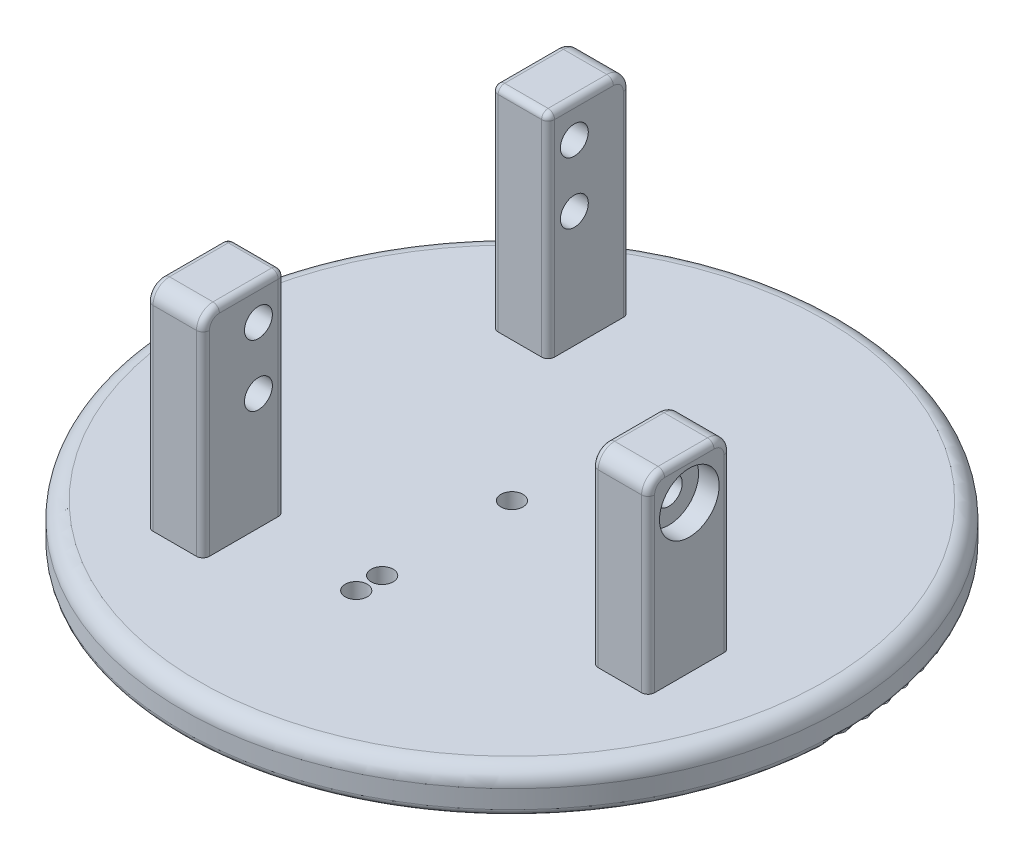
SolidWorks part; units mm, degrees
ref_plane "Front Plane" through (0, 0, 0) normal (0, 0, 1) x (1, 0, 0)
ref_plane "Top Plane" through (0, 0, 0) normal (0, 1, 0) x (1, 0, 0)
ref_plane "Right Plane" through (0, 0, 0) normal (1, 0, 0) x (0, 0, -1)
imported_body "Arm base-1-solid1"
sketch "Sketch1" plane through (-2.8531, 0, 0) normal (1, 0, 0) x (0, 0, -1)
  circle A0 centre (-17.6541, 12.3201) radius 2.15
  circle A1 centre (-17.6541, 2.8201) radius 2.15
extrude "Cut-Extrude1" cut sketch "Sketch1" against normal through all
sketch "Sketch2" plane through (-2.8531, 0, 0) normal (1, 0, 0) x (0, 0, -1)
  circle A0 centre (31.0407, 12.3201) radius 2.15
  circle A1 centre (31.0407, 2.8201) radius 2.15
extrude "Cut-Extrude2" cut sketch "Sketch2" against normal through all
sketch "Sketch4" plane through (0, 17.5701, 0) normal (0, 1, 0) x (1, 0, 0)
  line L0 (-15.5531, -26.2067) -> (-2.8531, -26.2067) construction
  line L1 (-15.5531, -13.5067) -> (-11.5531, -13.5067)
  line L2 (-15.5531, -13.5067) -> (-15.5531, -26.2067)
  line L3 (-15.5531, -26.2067) -> (-11.5531, -26.2067)
  line L4 (-11.5531, -13.5067) -> (-11.5531, -26.2067)
  dimension "D1" = 4
extrude "Cut-Extrude5" cut sketch "Sketch4" against normal up to surface (32.7 mm away)
sketch "Sketch5" plane through (0, 17.5701, 0) normal (0, 1, 0) x (1, 0, 0)
  line L0 (-15.5531, 26.8933) -> (-2.8531, 26.8933) construction
  line L1 (-15.5531, 26.8933) -> (-11.5531, 26.8933)
  line L2 (-15.5531, 26.8933) -> (-15.5531, 39.5933)
  line L3 (-15.5531, 39.5933) -> (-11.5531, 39.5933)
  line L4 (-11.5531, 26.8933) -> (-11.5531, 39.5933)
  line L5 (-15.5531, 26.8933) -> (-2.8531, 26.8933) construction
  line L6 (-2.8531, 39.5933) -> (-15.5531, 39.5933) construction
  dimension "D1" = 4
extrude "Cut-Extrude6" cut sketch "Sketch5" against normal up to surface (32.7 mm away)
sketch "Sketch6" plane through (0, 13.8185, 0) normal (0, 1, 0) x (1, 0, 0)
  line L0 (53.6619, 2.5933) -> (40.9619, 2.5933) construction
  line L1 (49.6619, 2.5933) -> (53.6619, 2.5933)
  line L2 (49.6619, 2.5933) -> (49.6619, -10.1067)
  line L3 (49.6619, -10.1067) -> (53.6619, -10.1067)
  line L4 (53.6619, 2.5933) -> (53.6619, -10.1067)
  dimension "D1" = 4
extrude "Cut-Extrude7" cut sketch "Sketch6" against normal up to surface (28.9484 mm away)
fillet "Fillet7" radius 1 1 edges at (13.0219, -21.4799, 45.2567)
sketch "Sketch7" plane through (0, -21.4799, 0) normal (0, -1, 0) x (1, 0, 0)
  line L0 (-36.7781, -5.5433) -> (13.0219, -5.5433) construction
  circle A1 centre (13.0219, -5.5433) radius 49.8 construction
  circle A2 centre (13.0219, -5.5433) radius 1.7
  circle A3 centre (13.0219, 14.4567) radius 1.7
  circle A4 centre (13.0219, 18.4567) radius 1.7
  dimension "D1" = 3.4
  dimension "D2" = 4
  dimension "D3" = 20
extrude "Cut-Extrude8" cut sketch "Sketch7" against normal through all
sketch "Sketch8" plane through (-11.5531, 0, 0) normal (-1, 0, 0) x (0, 0, 1)
  line L0 (-26.8933, 17.5701) -> (-37.0533, 17.5701) construction
  line L1 (-26.9933, 17.5701) -> (13.6067, 17.5701)
  line L2 (-26.9933, 17.5701) -> (-26.9933, -15.1299)
  line L3 (-26.9933, -15.1299) -> (13.6067, -15.1299)
  line L4 (13.6067, 17.5701) -> (13.6067, -15.1299)
  line L5 (26.2067, -15.1299) -> (13.5067, -15.1299) construction
  line L6 (-26.8933, -15.1299) -> (-26.8933, 17.5701) construction
  line L7 (13.5067, -15.1299) -> (13.5067, 17.5701) construction
  line L8 (-26.8933, 17.5701) -> (-26.8933, -15.1299)
  line L9 (13.5067, 17.5701) -> (13.5067, -15.1299)
  dimension "D1" = 0.1
  dimension "D2" = 0.1
extrude "Cut-Extrude9" cut sketch "Sketch8" against normal through all both and the other way through all contours L1 L9 L3 L4 | L2 M9 M7 M8
fillet "Fillet6" radius 1 19 edges at (-2.8531, -0.0499, 26.2067) (-2.8531, 16.8261, 25.4627) (-2.8531, 17.5701, 18.6367) (-11.5531, -0.0499, 26.2067) (-11.5531, 16.8261, 25.4627) (-11.5531, 17.5701, 18.6367) (49.6619, -1.9257, -2.5933) (49.6619, 13.0745, -1.8494) (49.6619, 13.8185, 3.7567) (49.6619, 13.0745, 9.3627) (49.6619, -1.9257, 10.1067) (40.9619, -1.9257, 10.1067) (40.9619, 13.0745, 9.3627) (40.9619, 13.8185, 3.7567) (40.9619, 13.0745, -1.8494) (40.9619, -1.9257, -2.5933) (-2.8531, 1.2201, 13.6067) (-11.5531, 1.2201, 13.6067) (-7.2031, 17.5701, 13.6067)
fillet "Fillet4" radius 1 9 edges at (-2.8531, 17.5701, -32.0233) (-2.8531, 16.8261, -38.8494) (-2.8531, -0.0499, -39.5933) (-11.5531, 16.8261, -38.8494) (-11.5531, -0.0499, -39.5933) (-11.5531, 17.5701, -32.0233) (-7.2031, 17.5701, -26.9933) (-2.8531, 1.2201, -26.9933) (-11.5531, 1.2201, -26.9933)
sketch "Sketch9" plane through (49.6619, 0, 0) normal (1, 0, 0) x (0, 0, -1)
  circle A0 centre (-3.7567, 7.5701) radius 4.6
  dimension "D1" = 9.2
extrude "Cut-Extrude10" cut sketch "Sketch9" against normal blind 3.175
